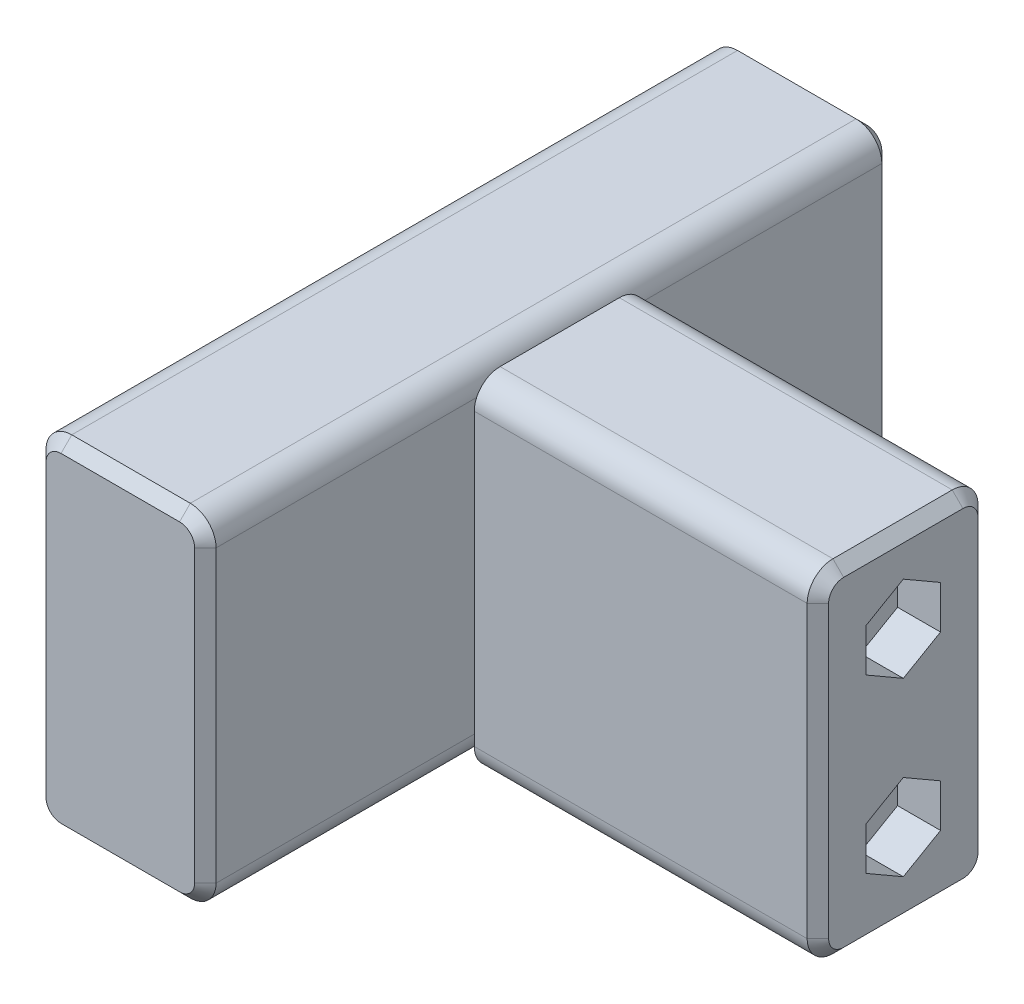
SolidWorks part; units mm, degrees
ref_plane "Front Plane" through (0, 0, 0) normal (0, 0, 1) x (1, 0, 0)
ref_plane "Top Plane" through (0, 0, 0) normal (0, 1, 0) x (1, 0, 0)
ref_plane "Right Plane" through (0, 0, 0) normal (1, 0, 0) x (0, 0, -1)
sketch "Sketch1" plane through (0, 0, 0) normal (0, 0, 1) x (1, 0, 0)
  line L1 (-8.763, -25.273) -> (8.763, -25.273)
  line L2 (-12.573, -21.463) -> (-12.573, 21.463)
  line L3 (-8.763, 25.273) -> (8.763, 25.273)
  line L4 (12.573, -21.463) -> (12.573, 21.463)
  line L5 (-12.573, -25.273) -> (12.573, 25.273) construction
  line L6 (-12.573, 25.273) -> (12.573, -25.273) construction
  arc A0 (-8.763, -25.273) -> (-12.573, -21.463) centre (-8.763, -21.463) cw
  arc A1 (8.763, -25.273) -> (12.573, -21.463) centre (8.763, -21.463) ccw
  arc A2 (8.763, 25.273) -> (12.573, 21.463) centre (8.763, 21.463) cw
  arc A3 (-12.573, 21.463) -> (-8.763, 25.273) centre (-8.763, 21.463) cw
  point P0 (0, 0)
  dimension "D3" = 3.81
  dimension "D1" = 25.146
  dimension "D2" = 50.546
extrude "Boss-Extrude1" add sketch "Sketch1" along normal mid plane 101.6
sketch "Sketch2" plane through (12.573, 0, 0) normal (1, 0, 0) x (0, 0, -1)
  line L0 (-50.8, 25.273) -> (50.8, 25.273) construction
  line L1 (-8.8185, -25.273) -> (8.8185, -25.273)
  line L2 (-12.6285, -21.463) -> (-12.6285, 21.463)
  line L3 (-8.8185, 25.273) -> (8.8185, 25.273)
  line L4 (12.6285, -21.463) -> (12.6285, 21.463)
  line L5 (-12.6285, -25.273) -> (12.6285, 25.273) construction
  line L6 (-12.6285, 25.273) -> (12.6285, -25.273) construction
  arc A0 (-8.8185, -25.273) -> (-12.6285, -21.463) centre (-8.8185, -21.463) cw
  arc A1 (8.8185, -25.273) -> (12.6285, -21.463) centre (8.8185, -21.463) ccw
  arc A2 (8.8185, 25.273) -> (12.6285, 21.463) centre (8.8185, 21.463) cw
  arc A3 (-12.6285, 21.463) -> (-8.8185, 25.273) centre (-8.8185, 21.463) cw
  point P0 (0, 0)
  dimension "D2" = 3.81
  dimension "D1" = 25.257
extrude "Boss-Extrude2" add sketch "Sketch2" along normal blind 50.8 from offset 1.5875 separate body
sketch "Sketch3" plane through (-12.573, 0, 0) normal (-1, 0, 0) x (0, 0, 1)
  line L0 (0, -12.7) -> (0, 12.7) construction
  circle A0 centre (0, 12.7) radius 3.175
  circle A1 centre (0, -12.7) radius 3.175
  point P4 (0, 0)
  dimension "D1" = 25.4
  dimension "D2" = 6.35
extrude "Cut-Extrude1" cut sketch "Sketch3" against normal through all
sketch "Sketch4" plane through (64.9605, 0, 0) normal (1, 0, 0) x (0, 0, -1)
  line L1 (0, 19.0509) -> (-5.5, 15.8754)
  line L2 (-5.5, 15.8754) -> (-5.5, 9.5246)
  line L3 (-5.5, 9.5246) -> (0, 6.3491)
  line L4 (0, 6.3491) -> (5.5, 9.5246)
  line L5 (5.5, 9.5246) -> (5.5, 15.8754)
  line L6 (5.5, 15.8754) -> (0, 19.0509)
  line L7 (0, -6.3491) -> (-5.5, -9.5246)
  line L8 (-5.5, -9.5246) -> (-5.5, -15.8754)
  line L9 (-5.5, -15.8754) -> (0, -19.0509)
  line L10 (0, -19.0509) -> (5.5, -15.8754)
  line L11 (5.5, -15.8754) -> (5.5, -9.5246)
  line L12 (5.5, -9.5246) -> (0, -6.3491)
  circle A0 centre (0, 12.7) radius 5.5 construction
  circle A1 centre (0, -12.7) radius 5.5 construction
  dimension "D1" = 11
  dimension "D2" = 11
extrude "Cut-Extrude2" cut sketch "Sketch4" against normal blind 6.35
chamfer "Chamfer1" distance 1.5875 angle 45 8 edges at (64.9605, 0, 12.6285) (64.9605, 24.1571, 11.5126) (64.9605, 25.273, 0) (64.9605, 24.1571, -11.5126) (64.9605, 0, -12.6285) (64.9605, -24.1571, -11.5126) (64.9605, -25.273, 0) (64.9605, -24.1571, 11.5126)
chamfer "Chamfer2" distance 1.5875 angle 45 16 edges at (0, -25.273, -50.8) (11.4571, -24.1571, -50.8) (12.573, 0, -50.8) (11.4571, 24.1571, -50.8) (0, 25.273, -50.8) (-11.4571, 24.1571, -50.8) (-12.573, 0, -50.8) (-11.4571, -24.1571, -50.8) (-12.573, 0, 50.8) (-11.4571, 24.1571, 50.8) (0, 25.273, 50.8) (11.4571, 24.1571, 50.8) (12.573, 0, 50.8) (11.4571, -24.1571, 50.8) (0, -25.273, 50.8) (-11.4571, -24.1571, 50.8)
